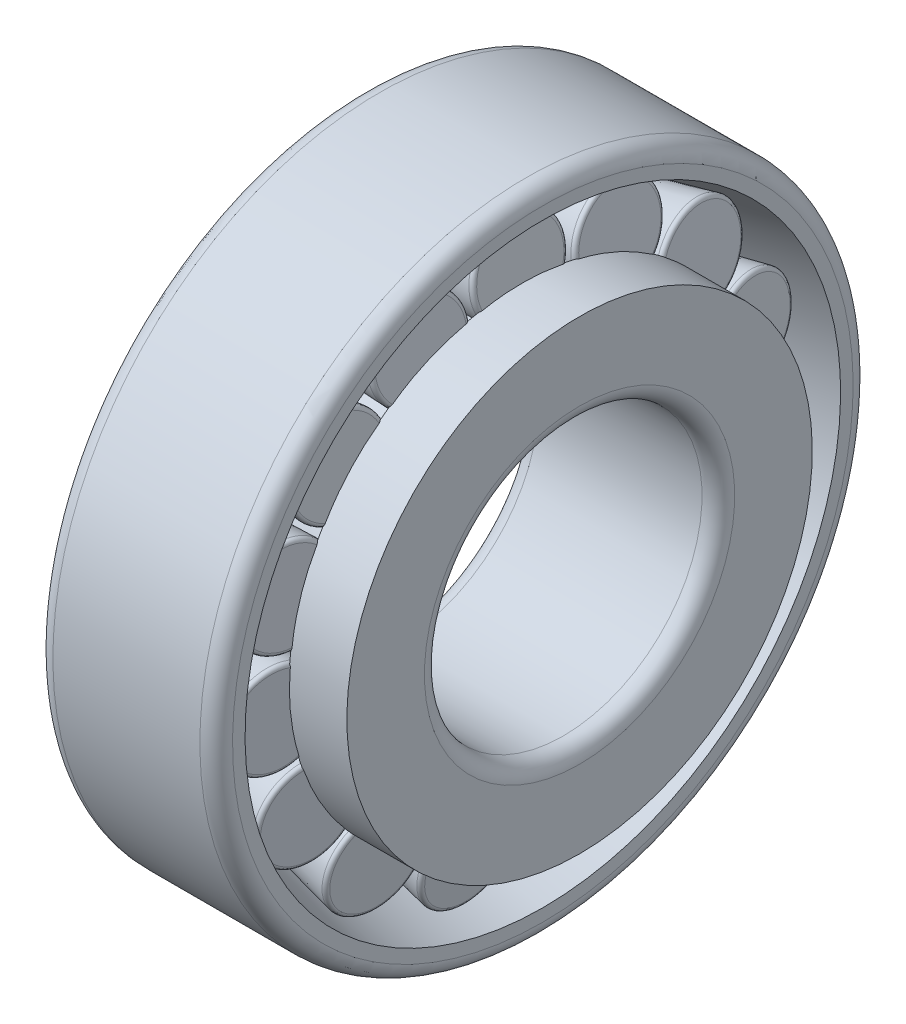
SolidWorks part; units mm, degrees
ref_plane "Front" through (0, 0, 0) normal (0, 0, 1) x (1, 0, 0)
ref_plane "Top" through (0, 0, 0) normal (0, 1, 0) x (1, 0, 0)
ref_plane "Right" through (0, 0, 0) normal (1, 0, 0) x (0, 0, -1)
sketch "Sketch1" plane through (0, 0, 0) normal (0, 0, 1) x (1, 0, 0)
  line L0 (7.75, 0) -> (13.9916, 0) construction
  line L1 (5.5, 18.234) -> (5.5, 19)
  line L2 (4.5, 20) -> (-4.5, 20)
  line L3 (-5.5, 19) -> (-5.5, 15.704)
  line L4 (-5.5, 15.704) -> (5.5, 18.234)
  line L5 (-4.25, 9.5) -> (-4.25, 13.2409)
  line L6 (-3.25, 8.5) -> (6.75, 8.5)
  line L7 (7.75, 9.5) -> (7.75, 15.1264)
  line L8 (-2.9724, 11.7409) -> (-3.5875, 16.1439)
  line L9 (4.5, 12.1264) -> (3.7044, 17.8211)
  line L10 (-3.2799, 13.9424) -> (4.1022, 14.9737) construction
  line L11 (-2.9724, 11.7409) -> (4.5, 12.1264)
  line L12 (4.0809, 14.25) -> (7.75, 14.25)
  line L13 (7.75, 15.1264) -> (4.0809, 15.1264)
  line L14 (-4.25, 13.2409) -> (-3.1819, 13.2409)
  arc A0 (-4.5, 20) -> (-5.5, 19) centre (-4.5, 19) ccw
  arc A1 (5.5, 19) -> (4.5, 20) centre (4.5, 19) ccw
  arc A2 (-3.25, 8.5) -> (-4.25, 9.5) centre (-3.25, 9.5) cw
  arc A3 (6.75, 8.5) -> (7.75, 9.5) centre (6.75, 9.5) ccw
  point P19 (-5.5, 20)
  point P22 (5.5, 20)
  point P24 (0, 20)
  point P29 (-4.25, 8.5)
  point P32 (7.75, 8.5)
  dimension "XR12" = 1
  dimension "XR34" = 1
  dimension "D1" = 11.3375
  dimension "DD" = 40
  dimension "D2" = 3.25
  dimension "DT" = 13.25
  dimension "D3" = 3
  dimension "DE" = 31.408
  dimension "D4" = 1.5
  dimension "DC" = 11
  dimension "XD" = 17
  dimension "D7" = 5
  dimension "gzzj" = 5.75
  dimension "DB" = 12
  dimension "XALF" = 12.953
  dimension "ZJ" = 28.5
revolve "Revolve1" add sketch "Sketch1" angle 360 about L0
sketch "Sketch2" plane through (0, 0, 0) normal (0, 0, 1) x (1, 0, 0)
  line L0 (-3.2997, 13.9396) -> (10.7958, 15.9088) construction
  line L4 (-3.2799, 13.9424) -> (4.1022, 14.9737) construction
  line L5 (-3.2997, 13.9396) -> (4.122, 14.9765)
  line L7 (-3.6073, 16.1411) -> (-2.9897, 11.72)
  line L8 (4.5228, 12.1075) -> (3.7242, 17.8238)
  line L9 (-2.9897, 11.72) -> (4.5228, 12.1075)
  line L10 (-3.2997, 13.9396) -> (-3.0188, 11.9287)
  line L11 (4.4881, 12.3561) -> (4.122, 14.9765)
  line L12 (-2.7792, 11.7308) -> (4.2722, 12.0946)
  arc A0 (-2.7792, 11.7308) -> (-3.0188, 11.9287) centre (-2.791, 11.9605) cw
  arc A1 (4.2722, 12.0946) -> (4.4881, 12.3561) centre (4.2603, 12.3243) ccw
  dimension "D2" = 0.23
  dimension "D1" = 0.02
revolve "Revolve2" add sketch "Sketch2" angle 360 about L0
sketch "Sketch3" plane through (0, 0, 0) normal (0, 0, 1) x (1, 0, 0)
  line L0 (-5.5, 15.704) -> (5.5, 18.234) construction
  line L1 (-5.5, 19) -> (-5.5, 15.704) construction
  line L2 (4.5, 20) -> (-4.5, 20) construction
  line L3 (5.5, 18.234) -> (5.5, 19) construction
  line L4 (-5.5, 15.704) -> (5.5, 18.234)
  line L5 (-5.5, 19) -> (-5.5, 15.704)
  line L6 (4.5, 20) -> (-4.5, 20)
  line L7 (5.5, 18.234) -> (5.5, 19)
  arc A0 (-4.5, 20) -> (-5.5, 19) centre (-4.5, 19) ccw construction
  arc A1 (5.5, 19) -> (4.5, 20) centre (4.5, 19) ccw construction
  arc A2 (-4.5, 20) -> (-5.5, 19) centre (-4.5, 19) ccw
  arc A3 (5.5, 19) -> (4.5, 20) centre (4.5, 19) ccw
revolve "Revolve3" add sketch "Sketch3" angle 360 about axis through (7.75, 0, 0) along (1, 0, 0)
pattern_circular "Circular-Pattern1" count 15 over 360 about axis through (0, 0, 0) along (1, 0, 0) of "Revolve2"
equation "\"gzzj@Sketch1\" =  ( \"DD@Sketch1\" - \"XD@Sketch1\" )  / 4"
equation "\"D1@Sketch1\" = \"DB@Sketch1\" - \"DT@Sketch1\" / 20"
equation "\"D2@Sketch1\" = \"DT@Sketch1\" - \"DC@Sketch1\" + \"XR12@Sketch1\""
equation "\"D4@Sketch1\" = \"D3@Sketch1\" / 2"
equation "\"D2@Sketch2\" = \"gzzj@Sketch1\" / 25"
equation "\"ZJ@Sketch1\" =  ( \"DD@Sketch1\" + \"XD@Sketch1\" )  / 2"
equation "\"D1@Circular-Pattern1\" = int( 3.14159265 / atn(( \"gzzj@Sketch1\" / 2) / sqr( \"ZJ@Sketch1\" * \"ZJ@Sketch1\" /4 - ( \"gzzj@Sketch1\"/ 2) *  ( \"gzzj@Sketch1\"/ 2))))"
